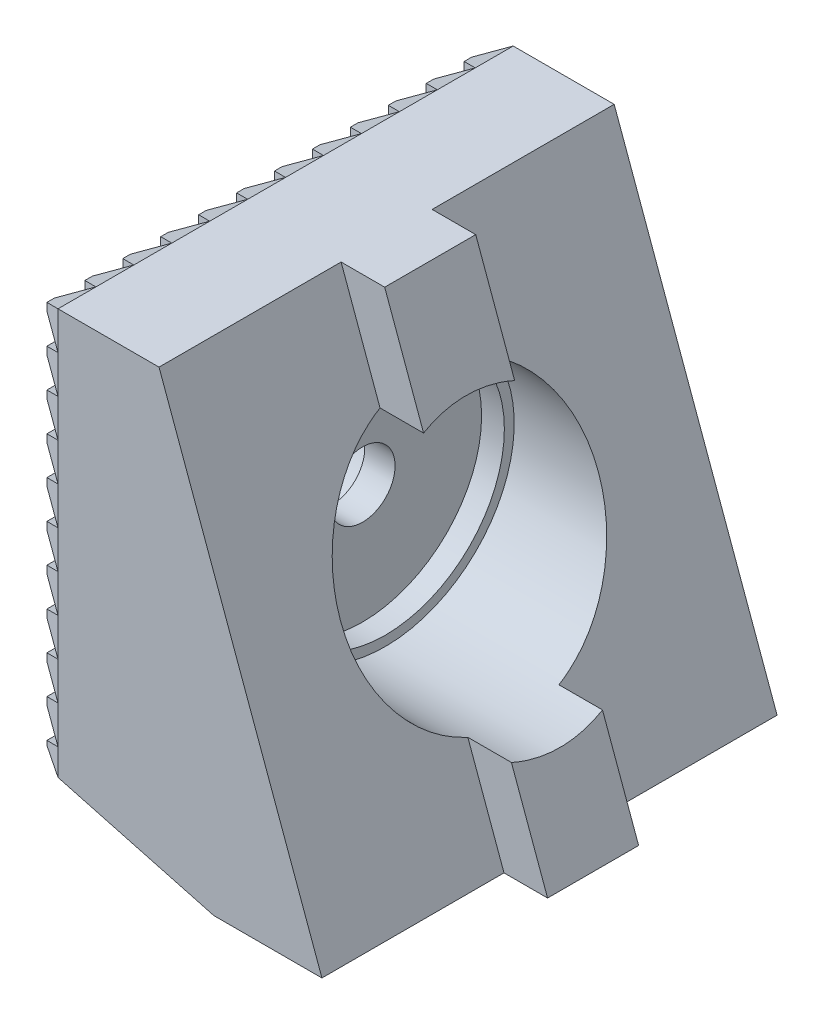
SolidWorks part; units mm, degrees
ref_plane "Front Plane" through (0, 0, 0) normal (0, 0, 1) x (1, 0, 0)
ref_plane "Top Plane" through (0, 0, 0) normal (0, 1, 0) x (1, 0, 0)
ref_plane "Right Plane" through (0, 0, 0) normal (1, 0, 0) x (0, 0, -1)
ref_plane "Plane1" through (0, 0, 0) normal (0, 0, 1) x (1, 0, 0)
sketch "Sketch1" plane through (0, 0, 0) normal (0, 0, 1) x (1, 0, 0)
  line L0 (-22, 28) -> (-20.2679, 27)
  line L1 (-20.2679, 27) -> (-22, 26)
  line L2 (-22, 26) -> (-22, 25.5)
  line L3 (-22, 25.5) -> (-20.2679, 24.5)
  line L4 (-20.2679, 24.5) -> (-22, 23.5)
  line L5 (-22, 23.5) -> (-22, 23)
  line L6 (-22, 23) -> (-20.2679, 22)
  line L7 (-20.2679, 22) -> (-22, 21)
  line L8 (-22, 21) -> (-22, 20.5)
  line L9 (-22, 20.5) -> (-20.2679, 19.5)
  line L10 (-20.2679, 19.5) -> (-22, 18.5)
  line L11 (-22, 18.5) -> (-22, 18)
  line L12 (-22, 18) -> (-20.2679, 17)
  line L13 (-20.2679, 17) -> (-22, 16)
  line L14 (-22, 16) -> (-22, 15.5)
  line L15 (-22, 15.5) -> (-20.2679, 14.5)
  line L16 (-20.2679, 14.5) -> (-22, 13.5)
  line L17 (-22, 13.5) -> (-22, 13)
  line L18 (-22, 13) -> (-20.2679, 12)
  line L19 (-20.2679, 12) -> (-22, 11)
  line L20 (-22, 11) -> (-22, 10.5)
  line L21 (-22, 10.5) -> (-20.2679, 9.5)
  line L22 (-20.2679, 9.5) -> (-22, 8.5)
  line L23 (-22, 8.5) -> (-22, 8)
  line L24 (-22, 8) -> (-20.2679, 7)
  line L25 (-20.2679, 7) -> (-22, 6)
  line L26 (-22, 6) -> (-22, 5.5)
  line L27 (-22, 5.5) -> (-20.2679, 4.5)
  line L28 (-20.2679, 4.5) -> (-22, 3.5)
  line L29 (-22, 3.5) -> (-22, 3.2154)
  line L30 (-22, 3.2154) -> (-10, 0)
  line L31 (-10, 0) -> (-2.8733, 0)
  line L32 (-2.8733, 0) -> (-13.6104, 29.5)
  line L33 (-13.6104, 29.5) -> (-20.2679, 29.5)
  line L34 (-20.2679, 29.5) -> (-22, 28.5)
  line L35 (-22, 28.5) -> (-22, 28)
extrude "Extrude1" add sketch "Sketch1" along normal blind 30
ref_plane "Plane2" through (0, 0, 15) normal (0, 0, 1) x (1, 0, 0)
sketch "Sketch2" plane through (0, 0, 15) normal (0, 0, 1) x (1, 0, 0)
  line L0 (-13.6104, 29.5) -> (-2.8733, 0)
  line L1 (-2.8733, 0) -> (0, 0)
  line L2 (0, 0) -> (-10.7371, 29.5)
  line L3 (-10.7371, 29.5) -> (-13.6104, 29.5)
extrude "Extrude2" add sketch "Sketch2" against normal blind 3 and the other way blind 3
ref_plane "Plane3" through (0, 0, 15) normal (0, 0, 1) x (1, 0, 0)
sketch "Sketch3" plane through (0, 0, 15) normal (0, 0, 1) x (1, 0, 0)
  line L0 (-22, 14.5) -> (-22, 18.5)
  line L1 (-22, 18.5) -> (-17.2, 18.5)
  line L2 (-17.2, 18.5) -> (-17.2, 16.65)
  line L3 (-17.2, 16.65) -> (-15.2, 16.65)
  line L4 (-15.2, 16.65) -> (-15.2, 22.35)
  line L5 (-15.2, 22.35) -> (-13.7, 22.35)
  line L6 (-13.7, 22.35) -> (-13.7, 23)
  line L7 (-13.7, 23) -> (0, 23)
  line L8 (0, 23) -> (0, 14.5)
  line L9 (0, 14.5) -> (-22, 14.5)
  line L10 (0, 14.5) -> (-22, 14.5) construction
revolve "Cut-Revolve1" cut sketch "Sketch3" angle 360 about L10
ref_plane "Plane4" through (0, 0, 0) normal (0, 1, 0) x (-1, 0, 0)
sketch "Sketch4" plane through (0, 0, 0) normal (0, 1, 0) x (-1, 0, 0)
  line L0 (50, -2) -> (50, 31.5)
  line L1 (50, 31.5) -> (17.6699, 31.5)
  line L2 (17.6699, 31.5) -> (22, 29)
  line L3 (22, 29) -> (22, 28.5)
  line L4 (22, 28.5) -> (20.2679, 27.5)
  line L5 (20.2679, 27.5) -> (22, 26.5)
  line L6 (22, 26.5) -> (22, 26)
  line L7 (22, 26) -> (20.2679, 25)
  line L8 (20.2679, 25) -> (22, 24)
  line L9 (22, 24) -> (22, 23.5)
  line L10 (22, 23.5) -> (20.2679, 22.5)
  line L11 (20.2679, 22.5) -> (22, 21.5)
  line L12 (22, 21.5) -> (22, 21)
  line L13 (22, 21) -> (20.2679, 20)
  line L14 (20.2679, 20) -> (22, 19)
  line L15 (22, 19) -> (22, 18.5)
  line L16 (22, 18.5) -> (20.2679, 17.5)
  line L17 (20.2679, 17.5) -> (22, 16.5)
  line L18 (22, 16.5) -> (22, 16)
  line L19 (22, 16) -> (20.2679, 15)
  line L20 (20.2679, 15) -> (22, 14)
  line L21 (22, 14) -> (22, 13.5)
  line L22 (22, 13.5) -> (20.2679, 12.5)
  line L23 (20.2679, 12.5) -> (22, 11.5)
  line L24 (22, 11.5) -> (22, 11)
  line L25 (22, 11) -> (20.2679, 10)
  line L26 (20.2679, 10) -> (22, 9)
  line L27 (22, 9) -> (22, 8.5)
  line L28 (22, 8.5) -> (20.2679, 7.5)
  line L29 (20.2679, 7.5) -> (22, 6.5)
  line L30 (22, 6.5) -> (22, 6)
  line L31 (22, 6) -> (20.2679, 5)
  line L32 (20.2679, 5) -> (22, 4)
  line L33 (22, 4) -> (22, 3.5)
  line L34 (22, 3.5) -> (20.2679, 2.5)
  line L35 (20.2679, 2.5) -> (22, 1.5)
  line L36 (22, 1.5) -> (22, 1)
  line L37 (22, 1) -> (16.8038, -2)
  line L38 (16.8038, -2) -> (50, -2)
extrude "Cut-Extrude1" cut sketch "Sketch4" along normal blind 29.5
